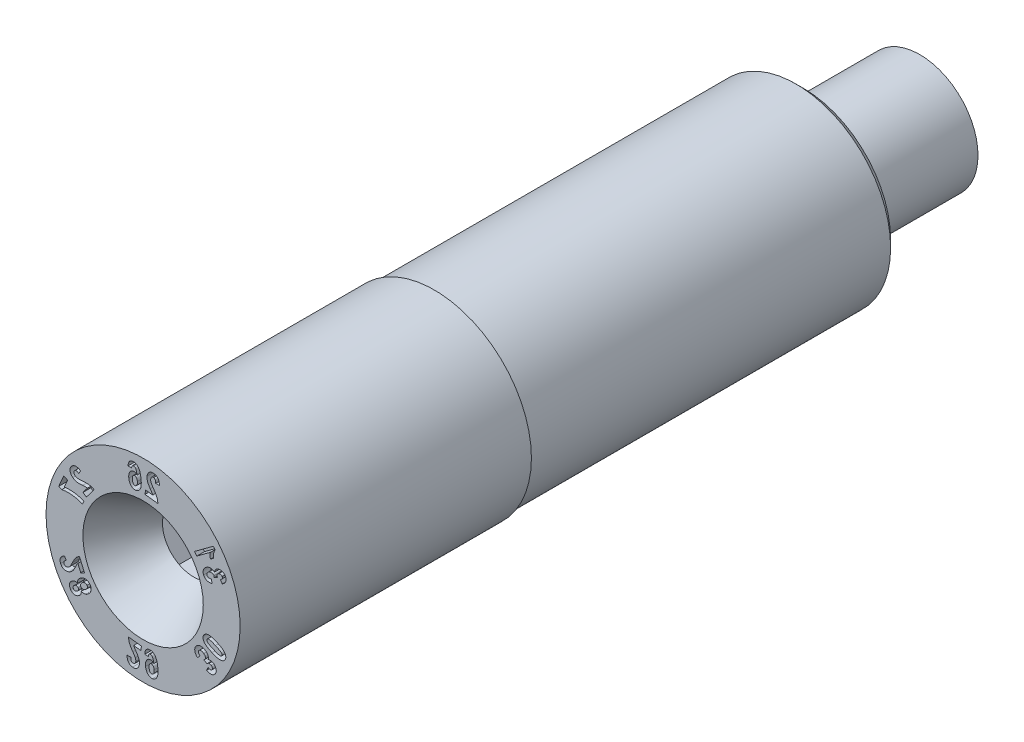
SolidWorks part; units mm, degrees
other "<M3L6-SetScrew>-<Chamfer1>"
ref_plane "Front Plane" through (0, 0, 0) normal (0, 0, 1) x (1, 0, 0)
ref_plane "Top Plane" through (0, 0, 0) normal (0, 1, 0) x (1, 0, 0)
ref_plane "Right Plane" through (0, 0, 0) normal (1, 0, 0) x (0, 0, -1)
sketch "Sketch1" plane through (0, 0, 0) normal (1, 0, 0) x (0, 0, -1)
  line L0 (1.299, 0.8) -> (0, 1.55)
  line L2 (0, 2.5) -> (0, 1.55)
  line L3 (16.75, 2.5) -> (0, 2.5)
  line L4 (-3.7979, 0) -> (49996.2021, 0) construction
  line L8 (14, 0.8) -> (1.299, 0.8)
  line L12 (17, 1.5) -> (17, 2.25)
  line L16 (17, 2.25) -> (16.75, 2.5)
  line L17 (17, 1.5) -> (14, 1.5)
  line L18 (14, 0.8) -> (14, 1.5)
  dimension "D1" = 17
  dimension "D2" = 45
  dimension "D3" = 0.25
  dimension "D4" = 5
  dimension "D5" = 30
  dimension "D6" = 1.55
  dimension "D7" = 1.6
  dimension "D8" = 3
  dimension "D9" = 3
revolve "Revolve1" add sketch "Sketch1" angle 360 about L4
sketch "Sketch5" plane through (0, 0, 0) normal (1, 0, 0) x (0, 0, -1)
  line L0 (0, 0) -> (50000, 0) construction
  line L1 (0, 2.5) -> (0, -2.5) construction
  line L2 (7.5, 2.435) -> (17, 2.435)
  line L3 (7.5, 2.435) -> (7.5, 3.435)
  line L4 (7.5, 3.435) -> (17, 3.435)
  line L5 (17, 2.435) -> (17, 3.435)
  line L6 (17, -2.25) -> (17, 2.25) construction
  line L7 (16.75, 2.5) -> (0, 2.5) construction
  dimension "D1" = 7.5
  dimension "D2" = 0.065
  dimension "D3" = 1
revolve "Cut-Revolve1" cut sketch "Sketch5" angle 360 about L0
sketch "Sketch2" plane through (0, 0, 0) normal (0, 0, 1) x (1, 0, 0)
  line L0 (0, 0) -> (0, 2.5) construction
  line L1 (0, 0) -> (2.1651, 1.25) construction
  line L2 (0, 0) -> (2.1651, -1.25) construction
  line L3 (0, 0) -> (0, -2.5) construction
  line L4 (0, 0) -> (-2.1651, -1.25) construction
  line L5 (0, 0) -> (-2.1651, 1.25) construction
  arc A0 (0.3956, 1.6726) -> (0.8362, 1.5016) centre (0, 0) ccw construction
  circle A1 centre (0, 0) radius 2.5 construction
  text T0 "26     27     28     29     30     31" font "Arial Narrow" height 0.6
  point P17 (0, 0)
  point P21 (0, 0)
  dimension "D1" = 3.4375
  dimension "D2" = 6
extrude "Cut-Extrude1" cut sketch "Sketch2" against normal blind 0.2
ref_plane "Plane1" through (0, 0, -1.299) normal (0, 0, 1) x (1, 0, 0)
sketch "Sketch6" plane through (0, 0, -1.299) normal (0, 0, 1) x (1, 0, 0)
  line L1 (0.9238, 0) -> (0.4619, 0.8)
  line L2 (0.4619, 0.8) -> (-0.4619, 0.8)
  line L3 (-0.4619, 0.8) -> (-0.9238, 0)
  line L4 (-0.9238, 0) -> (-0.4619, -0.8)
  line L5 (-0.4619, -0.8) -> (0.4619, -0.8)
  line L6 (0.4619, -0.8) -> (0.9238, 0)
  circle A0 centre (0, 0) radius 0.8 construction
  circle A1 centre (0, 0) radius 0.8 construction
  point P11 (0, 0.8)
extrude "Cut-Extrude2" cut sketch "Sketch6" against normal blind 1.6
inserted part "M3L6-SetScrew"
move or copy body "Body-Move/Copy2" placed by mates yes
other "Distance1" parameters "D1"=3
